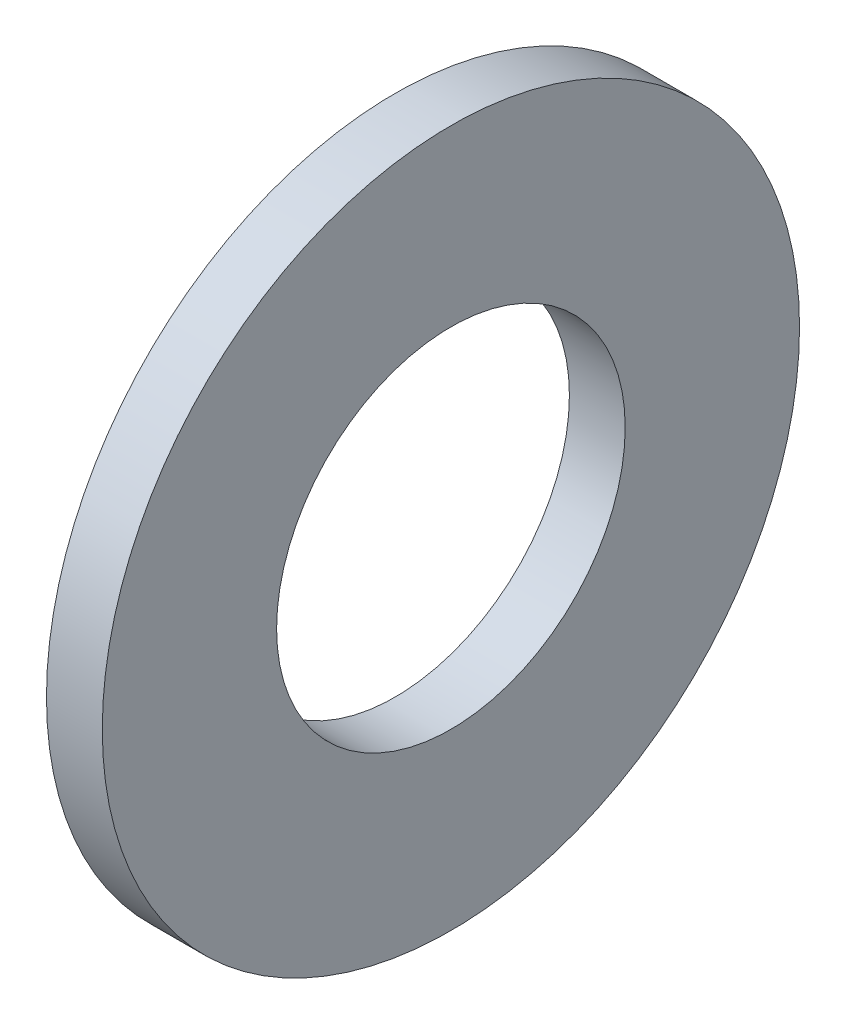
SolidWorks part; units mm, degrees
ref_plane "Plane1" through (0, 0, 0) normal (0, 0, 1) x (1, 0, 0)
ref_plane "Plane2" through (0, 0, 0) normal (0, 1, 0) x (1, 0, 0)
ref_plane "Plane3" through (0, 0, 0) normal (1, 0, 0) x (0, 0, -1)
sketch "Sketch1" plane through (0, 0, 0) normal (0, 0, 1) x (1, 0, 0)
  line L0 (-34.925, 0) -> (9.525, 0) construction
  line L1 (0, 5.1562) -> (0, 10.3124)
  line L2 (0, 10.3124) -> (-1.651, 10.3124)
  line L3 (-1.651, 10.3124) -> (-1.651, 5.1562)
  line L4 (-1.651, 5.1562) -> (0, 5.1562)
  dimension "Thickness" = 1.651
  dimension "Inside_dia" = 10.3124
  dimension "Outside_dia" = 20.6248
revolve "Base-Revolve" add sketch "Sketch1" angle 360 about L0
